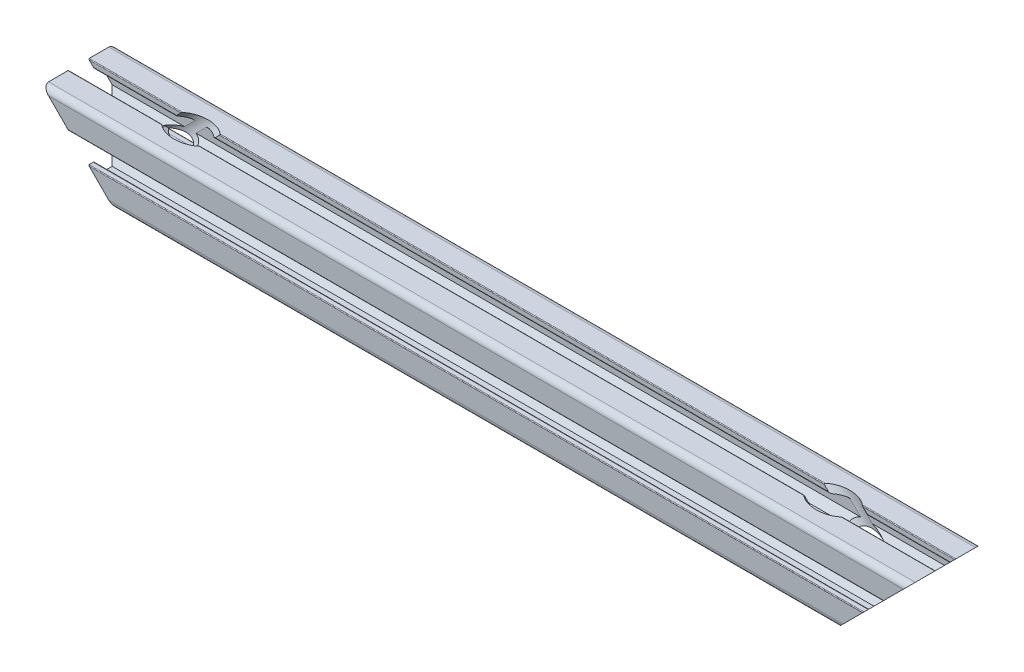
SolidWorks part; units mm, degrees
ref_plane "Front Plane" through (0, 0, 0) normal (0, 0, 1) x (1, 0, 0)
ref_plane "Top Plane" through (0, 0, 0) normal (0, 1, 0) x (1, 0, 0)
ref_plane "Right Plane" through (0, 0, 0) normal (1, 0, 0) x (0, 0, -1)
sketch3d "3DSketch1"
  line L0 (150, 0, 0) -> (-210, 0, 0)
  dimension "D1" = 360
  dimension "D2" = 150
other "30-sarja 1.0005 30X30(1)"
ref_plane "Plane1" through (150, 0, 0) normal (-1, 0, 0) x (0, 0, 1)
sketch "Model" plane through (150, 0, 0) normal (-1, 0, 0) x (0, 0, 1)
  line L0 (-3.3633, -1.9491) -> (-3.6416, -2.2274)
  line L1 (-3.6416, -2.2274) -> (-3.8647, -3.2771)
  line L2 (-3.2703, -3.8633) -> (-2.2274, -3.6416)
  line L3 (-2.2274, -3.6416) -> (-1.9491, -3.3633)
  line L4 (1.7935, -3.2077) -> (2.2274, -3.6416)
  line L5 (2.2274, -3.6416) -> (3.2703, -3.8633)
  line L6 (3.8647, -3.2771) -> (3.6416, -2.2274)
  line L7 (3.6416, -2.2274) -> (3.3633, -1.9491)
  line L8 (3.3633, 1.9491) -> (3.6416, 2.2274)
  line L9 (3.6416, 2.2274) -> (3.8647, 3.2771)
  line L10 (3.1951, 3.8473) -> (2.2274, 3.6416)
  line L11 (2.2274, 3.6416) -> (1.9491, 3.3633)
  line L12 (-1.9491, 3.3633) -> (-2.2274, 3.6416)
  line L13 (-2.2274, 3.6416) -> (-3.2703, 3.8633)
  line L14 (-3.8647, 3.2771) -> (-3.6416, 2.2274)
  line L15 (-3.6416, 2.2274) -> (-3.3633, 1.9491)
  line L16 (-15, 12.5) -> (-15, 4.4)
  line L17 (-4.4, 15) -> (-12.5, 15)
  line L18 (-4.1, 13) -> (-4.1, 14.7)
  line L19 (-6.5, 12.5) -> (-4.6, 12.5)
  line L20 (-6.8, 7.86) -> (-6.8, 12.2)
  line L21 (-3.94, 5) -> (-6.8, 7.86)
  line L22 (3.94, 5) -> (-3.94, 5)
  line L23 (6.8, 7.86) -> (3.94, 5)
  line L24 (6.8, 12.2) -> (6.8, 7.86)
  line L25 (4.6, 12.5) -> (6.5, 12.5)
  line L26 (4.1, 14.7) -> (4.1, 13)
  line L27 (12.5, 15) -> (4.4, 15)
  line L28 (15, 4.4) -> (15, 12.5)
  line L29 (13, 4.1) -> (14.7, 4.1)
  line L30 (12.5, 6.5) -> (12.5, 4.6)
  line L31 (7.86, 6.8) -> (12.2, 6.8)
  line L32 (5, 3.94) -> (7.86, 6.8)
  line L33 (5, -3.94) -> (5, 3.94)
  line L34 (7.86, -6.8) -> (5, -3.94)
  line L35 (12.2, -6.8) -> (7.86, -6.8)
  line L36 (12.5, -4.6) -> (12.5, -6.5)
  line L37 (14.7, -4.1) -> (13, -4.1)
  line L38 (15, -12.5) -> (15, -4.4)
  line L39 (4.4, -15) -> (12.5, -15)
  line L40 (4.1, -13) -> (4.1, -14.7)
  line L41 (6.5, -12.5) -> (4.6, -12.5)
  line L42 (6.8, -7.86) -> (6.8, -12.2)
  line L43 (3.94, -5) -> (6.8, -7.86)
  line L44 (-3.94, -5) -> (3.94, -5)
  line L45 (-6.8, -7.86) -> (-3.94, -5)
  line L46 (-6.8, -12.2) -> (-6.8, -7.86)
  line L47 (-4.6, -12.5) -> (-6.5, -12.5)
  line L48 (-4.1, -14.7) -> (-4.1, -13)
  line L49 (-12.5, -15) -> (-4.4, -15)
  line L50 (-15, -4.4) -> (-15, -12.5)
  line L51 (-13, -4.1) -> (-14.7, -4.1)
  line L52 (-12.5, -6.5) -> (-12.5, -4.6)
  line L53 (-7.86, -6.8) -> (-12.2, -6.8)
  line L54 (-5, -3.94) -> (-7.86, -6.8)
  line L55 (-5, 3.94) -> (-5, -3.94)
  line L56 (-7.86, 6.8) -> (-5, 3.94)
  line L57 (-12.2, 6.8) -> (-7.86, 6.8)
  line L58 (-12.5, 4.6) -> (-12.5, 6.5)
  line L59 (-14.7, 4.1) -> (-13, 4.1)
  arc A0 (-3.8647, -3.2771) -> (-3.2703, -3.8633) centre (-3.3742, -3.3742) ccw
  arc A1 (-1.6059, -3.3056) -> (-1.9491, -3.3633) centre (-1.7369, -3.5754) ccw
  arc A2 (-1.6059, -3.3056) -> (1.7935, -3.2077) centre (0, 0) ccw
  arc A3 (3.2703, -3.8633) -> (3.8647, -3.2771) centre (3.3742, -3.3742) ccw
  arc A4 (3.3056, -1.6059) -> (3.3633, -1.9491) centre (3.5754, -1.7369) ccw
  arc A5 (3.3056, -1.6059) -> (3.3056, 1.6059) centre (0, 0) ccw
  arc A6 (3.3633, 1.9491) -> (3.3056, 1.6059) centre (3.5754, 1.7369) ccw
  arc A7 (3.8647, 3.2771) -> (3.1951, 3.8473) centre (3.3756, 3.381) ccw
  arc A8 (1.6059, 3.3056) -> (1.9491, 3.3633) centre (1.7369, 3.5754) ccw
  arc A9 (1.6059, 3.3056) -> (-1.6059, 3.3056) centre (0, 0) ccw
  arc A10 (-1.9491, 3.3633) -> (-1.6059, 3.3056) centre (-1.7369, 3.5754) ccw
  arc A11 (-3.2703, 3.8633) -> (-3.8647, 3.2771) centre (-3.3742, 3.3742) ccw
  arc A12 (-3.3056, 1.6059) -> (-3.3633, 1.9491) centre (-3.5754, 1.7369) ccw
  arc A13 (-3.3056, 1.6059) -> (-3.3056, -1.6059) centre (0, 0) ccw
  arc A14 (-3.3633, -1.9491) -> (-3.3056, -1.6059) centre (-3.5754, -1.7369) ccw
  circle A15 centre (10.9, -10.9) radius 3.1
  circle A16 centre (-10.9, 10.9) radius 3.1
  arc A17 (-12.5, 15) -> (-15, 12.5) centre (-12.5, 12.5) ccw
  arc A18 (-4.1, 14.7) -> (-4.4, 15) centre (-4.4, 14.7) ccw
  arc A19 (-4.6, 12.5) -> (-4.1, 13) centre (-4.6, 13) ccw
  arc A20 (-6.5, 12.5) -> (-6.8, 12.2) centre (-6.5, 12.2) ccw
  arc A21 (6.8, 12.2) -> (6.5, 12.5) centre (6.5, 12.2) ccw
  arc A22 (4.1, 13) -> (4.6, 12.5) centre (4.6, 13) ccw
  arc A23 (4.4, 15) -> (4.1, 14.7) centre (4.4, 14.7) ccw
  arc A24 (15, 12.5) -> (12.5, 15) centre (12.5, 12.5) ccw
  arc A25 (14.7, 4.1) -> (15, 4.4) centre (14.7, 4.4) ccw
  arc A26 (12.5, 4.6) -> (13, 4.1) centre (13, 4.6) ccw
  arc A27 (12.5, 6.5) -> (12.2, 6.8) centre (12.2, 6.5) ccw
  arc A28 (12.2, -6.8) -> (12.5, -6.5) centre (12.2, -6.5) ccw
  arc A29 (13, -4.1) -> (12.5, -4.6) centre (13, -4.6) ccw
  arc A30 (15, -4.4) -> (14.7, -4.1) centre (14.7, -4.4) ccw
  arc A31 (12.5, -15) -> (15, -12.5) centre (12.5, -12.5) ccw
  arc A32 (4.1, -14.7) -> (4.4, -15) centre (4.4, -14.7) ccw
  arc A33 (4.6, -12.5) -> (4.1, -13) centre (4.6, -13) ccw
  arc A34 (6.5, -12.5) -> (6.8, -12.2) centre (6.5, -12.2) ccw
  arc A35 (-6.8, -12.2) -> (-6.5, -12.5) centre (-6.5, -12.2) ccw
  arc A36 (-4.1, -13) -> (-4.6, -12.5) centre (-4.6, -13) ccw
  arc A37 (-4.4, -15) -> (-4.1, -14.7) centre (-4.4, -14.7) ccw
  arc A38 (-15, -12.5) -> (-12.5, -15) centre (-12.5, -12.5) ccw
  arc A39 (-14.7, -4.1) -> (-15, -4.4) centre (-14.7, -4.4) ccw
  arc A40 (-12.5, -4.6) -> (-13, -4.1) centre (-13, -4.6) ccw
  arc A41 (-12.5, -6.5) -> (-12.2, -6.8) centre (-12.2, -6.5) ccw
  arc A42 (-12.2, 6.8) -> (-12.5, 6.5) centre (-12.2, 6.5) ccw
  arc A43 (-13, 4.1) -> (-12.5, 4.6) centre (-13, 4.6) ccw
  arc A44 (-15, 4.4) -> (-14.7, 4.1) centre (-14.7, 4.4) ccw
  circle A45 centre (10.9, 10.9) radius 3.1
  circle A46 centre (-10.9, -10.9) radius 3.1
  point P151 (0, 0)
  point P152 (-15, 15)
  point P153 (-15, -15)
  point P154 (15, -15)
  point P155 (15, 15)
  point P156 (0, 15)
  point P157 (0, -15)
  point P158 (-15, 0)
  point P159 (15, 0)
  point P160 (0, 0)
ref_plane "Plane3" through (-30, 0, 0) normal (1, 0, 0) x (0, 0, -1)
sketch "Sketch2" plane through (0, 0, 15) normal (0, 0, 1) x (1, 0, 0)
  line L0 (150, 15) -> (180, -15)
  line L1 (-210, -15) -> (150, -15) construction
  line L2 (150, 15) -> (227.2524, 15)
  line L3 (227.2524, 15) -> (227.2524, -15)
  line L4 (227.2524, -15) -> (180, -15)
  line L5 (0, -16.5) -> (0, 16.5) construction
  line L6 (-227.2524, 15) -> (-227.2524, -15)
  line L7 (-210, 15) -> (-227.2524, 15)
  line L8 (-210, 15) -> (-180, -15)
  line L9 (-227.2524, -15) -> (-180, -15)
  point P13 (-241.7234, 15)
  point P14 (-240.6107, -15)
  point P15 (0, 0)
  point P16 (0, 0)
  point P18 (-150, 15)
  point P19 (-210.3254, 14.8717)
  point P20 (0, 0)
  point P22 (0, 0)
  point P23 (0, 0)
  dimension "D1" = 45
  dimension "D2" = 30
extrude "Cut-Extrude1" cut sketch "Sketch2" against normal through all
mirror "Mirror4" about plane through (-30, 0, 0) normal (1, 0, 0) of "Cut-Extrude1"
ref_plane "Plane2" through (39.2157, -39.2157, 0) normal (0.7071, -0.7071, 0) x (0, 0, -1)
hole_wizard "CBORE for M8 Hex Head Bolt1" positions "Sketch5" profile "Sketch4" counterbore size "M8" standard "DIN"
sketch "Sketch5" plane through (39.2157, -39.2157, 0) normal (0.7071, -0.7071, 0) x (0, 0, -1)
  line L0 (4.4, 116.6726) -> (12.5, 116.6726) construction
  line L1 (15, -137.8858) -> (15, 113.1371) construction
  point P0 (0, 83.6726)
  point P3 (7.8501, 77.0683)
  dimension "D1" = 33
  dimension "D2" = 15
sketch "Sketch4" plane through (98.3812, 19.9497, 0) normal (0, 0, 1) x (-0.7071, -0.7071, 0)
  line L0 (0, 0) -> (0, 61.2132)
  line L1 (0, 61.2132) -> (4.25, 61.2132)
  line L3 (4.25, 61.2132) -> (4.25, 25)
  line L4 (4.25, 25) -> (7, 25)
  line L5 (7, 25) -> (7, 0)
  line L7 (7, 0) -> (0, 0)
  line L11 (0, -6.35) -> (0, 107.95) construction
  dimension "Thru Hole Dia." = 8.5
  dimension "Thru Hole Depth" = 61.2132
  dimension "C'Bore Dia." = 14
  dimension "C'Bore Depth" = 25
mirror "Mirror5" about plane through (-30, 0, 0) normal (1, 0, 0) of "CBORE for M8 Hex Head Bolt1"
